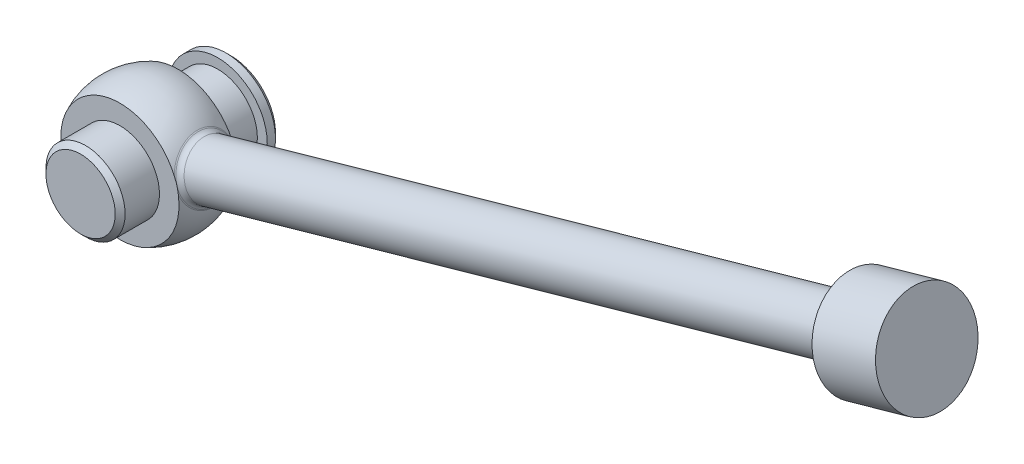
SolidWorks part; units mm, degrees
ref_plane "Plan de face" through (0, 0, 0) normal (0, 0, 1) x (1, 0, 0)
ref_plane "Plan de dessus" through (0, 0, 0) normal (0, 1, 0) x (1, 0, 0)
ref_plane "Plan de droite" through (0, 0, 0) normal (1, 0, 0) x (0, 0, -1)
imported_body "Importée5"
ref_plane "Plan2" through (-29.4297, 103.8399, 0) normal (-0.2727, 0.9621, 0) x (0.9621, 0.2727, 0)
sketch "Esquisse1" plane through (-29.4297, 103.8399, 837.5702) normal (-0.2727, 0.9621, 0) x (-0.9621, -0.2727, 0)
  line L0 (-230.3955, 115.9298) -> (-370.3955, 115.9298)
  line L2 (-370.3955, 115.9298) -> (-370.3955, 122.9298)
  line L3 (-370.3955, 122.9298) -> (-390.3955, 122.9298)
  line L4 (-390.3955, 122.9298) -> (-390.3955, 107.9298)
  line L7 (-390.3955, 107.9298) -> (-410.3955, 107.9298)
  line L10 (-410.3955, 107.9298) -> (-410.3955, 187.9298)
  line L11 (-410.3955, 187.9298) -> (-230.3955, 187.9298)
  line L12 (-230.3955, 187.9298) -> (-230.3955, 115.9298)
  line L14 (-165.0279, 115.9298) -> (-263.9312, 115.9298) construction
  line L16 (-263.9312, 107.9298) -> (-386.9312, 107.9298) construction
  line L17 (-165.0279, 107.9298) -> (-263.9312, 107.9298) construction
  line L18 (-150.3955, 101.2453) -> (-150.3955, 121.2987) construction
  point P4 (-150.3955, 107.9298)
  dimension "D1" = 220
  dimension "D2" = 20
  dimension "D3" = 180
  dimension "D4" = 80
  dimension "D5" = 15
  dimension "D6" = 80
revolve "Enlèvement de matière-Révolution2" cut sketch "Esquisse1" angle 360 about L7
sketch "Esquisse2" plane through (-29.4297, 103.8399, 0) normal (-0.2727, 0.9621, 0) x (0.9621, 0.2727, 0)
  line L0 (145.3955, -971.8241) -> (145.3955, -906.9967) construction
  line L2 (159.7457, -945.5) -> (175.5923, -945.5) construction
  line L3 (163.3767, -936.7042) -> (137.3628, -936.7042) construction
  line L4 (157.3955, -954.3794) -> (163.3163, -954.3794)
  line L5 (145.3955, -920.7042) -> (145.3955, -966.2958)
  line L6 (157.3955, -936.7042) -> (163.3574, -936.7042)
  line L7 (157.3955, -936.7042) -> (157.3955, -924.7042)
  line L8 (137.4196, -954.3794) -> (163.3713, -954.3794) construction
  line L9 (157.3955, -924.7042) -> (160.3955, -924.7042)
  line L10 (145.3955, -945.5) -> (123.5486, -945.5) construction
  line L11 (155.8955, -966.2958) -> (145.3955, -966.2958)
  line L12 (157.3955, -954.3794) -> (157.3955, -964.7958)
  line L13 (160.3955, -924.7042) -> (160.3955, -922.2042)
  line L14 (160.3955, -922.2042) -> (158.8955, -920.7042)
  line L15 (158.8955, -920.7042) -> (145.3955, -920.7042)
  line L16 (157.3955, -964.7958) -> (155.8955, -966.2958)
  arc A0 (163.3163, -954.3794) -> (163.3574, -936.7042) centre (145.3955, -945.5) ccw
  point P5 (157.3955, -966.2958)
  dimension "D2" = 20
  dimension "D3" = 12
  dimension "D4" = 24
  dimension "D5" = 4
  dimension "D6" = 1.5
  dimension "D7" = 45
  dimension "D8" = 30
  dimension "D9" = 5
revolve "Révolution1" add sketch "Esquisse2" angle 360 about L0
sketch "Esquisse3" plane through (-29.4297, 103.8399, 0) normal (-0.2727, 0.9621, 0) x (0.9621, 0.2727, 0)
  line L0 (145.3955, -933.6469) -> (145.3955, -969.2062) construction
  line L1 (165.0279, -945.5) -> (370.3955, -945.5) construction
  point P0 (145.3955, -945.5)
